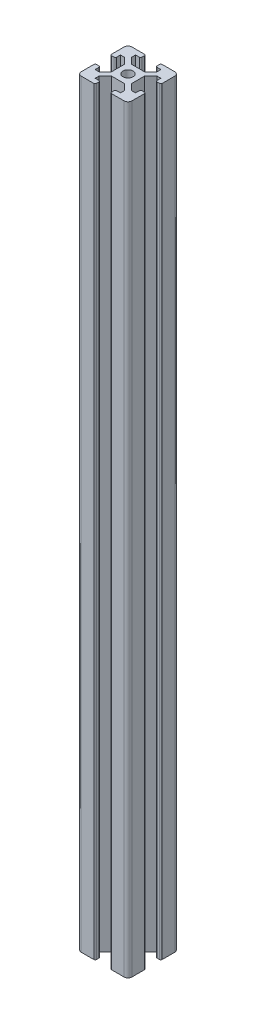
SolidWorks part; units mm, degrees
ref_plane "Alzado" through (0, 0, 0) normal (0, 0, 1) x (1, 0, 0)
ref_plane "Planta" through (0, 0, 0) normal (0, 1, 0) x (1, 0, 0)
ref_plane "Vista lateral" through (0, 0, 0) normal (1, 0, 0) x (0, 0, -1)
sketch "Croquis1" plane through (0, 0, 0) normal (0, 1, 0) x (1, 0, 0)
  line L0 (-10, 10) -> (-3, 10)
  line L1 (-2.5858, -4) -> (2.5858, -4)
  line L2 (-4, -2.5858) -> (-4, 2.5858)
  line L3 (-2.5858, 4) -> (2.5858, 4)
  line L4 (4, -2.5858) -> (4, 2.5858)
  line L5 (-4, -4) -> (4, 4) construction
  line L6 (-1.4142, 1.4142) -> (4, -4) construction
  line L11 (-10, -10) -> (10, 10) construction
  line L12 (5, 8) -> (5, 6.4142)
  line L13 (-3, 10) -> (-3, 8)
  line L20 (-8, 5) -> (-6.4142, 5)
  line L21 (-5, 8) -> (-5, 6.4142)
  line L30 (-3, 8) -> (-5, 8)
  line L31 (-10, 3) -> (-8, 3)
  line L32 (-8, 3) -> (-8, 5)
  line L33 (0, 14.0655) -> (0, -11.7776) construction
  line L34 (-14.7196, 0) -> (20.6254, 0) construction
  line L35 (-2.5858, 4) -> (-5, 6.4142)
  line L36 (-4, 2.5858) -> (-6.4142, 5)
  line L37 (3, 8) -> (5, 8)
  line L38 (3, 10) -> (3, 8)
  line L39 (10, 3) -> (8, 3)
  line L40 (-1.4142, 1.4142) -> (10, -10) construction
  line L41 (8, 3) -> (8, 5)
  line L42 (8, 5) -> (6.4142, 5)
  line L43 (4, 2.5858) -> (6.4142, 5)
  line L44 (2.5858, 4) -> (5, 6.4142)
  line L45 (10, -3) -> (8, -3)
  line L46 (8, -3) -> (8, -5)
  line L47 (8, -5) -> (6.4142, -5)
  line L48 (4, -2.5858) -> (6.4142, -5)
  line L49 (5, -8) -> (5, -6.4142)
  line L50 (2.5858, -4) -> (5, -6.4142)
  line L51 (3, -8) -> (5, -8)
  line L52 (3, -10) -> (3, -8)
  line L53 (-3, -10) -> (-3, -8)
  line L54 (-3, -8) -> (-5, -8)
  line L55 (-10, -3) -> (-8, -3)
  line L56 (-8, -3) -> (-8, -5)
  line L57 (-8, -5) -> (-6.4142, -5)
  line L58 (-4, -2.5858) -> (-6.4142, -5)
  line L59 (-2.5858, -4) -> (-5, -6.4142)
  line L60 (-5, -8) -> (-5, -6.4142)
  line L63 (-10, -3) -> (-10, -10)
  line L66 (3, 10) -> (10, 10)
  line L67 (-10, 10) -> (-10, 3)
  line L68 (10, 10) -> (10, 3)
  line L69 (-10, -10) -> (-3, -10)
  line L70 (3, -10) -> (10, -10)
  line L71 (10, -10) -> (10, -3)
  circle A0 centre (0, 0) radius 2
  point P0 (0, 0)
  dimension "D3" = 4
  dimension "D2" = 8
  dimension "D4" = 20
  dimension "D5" = 20
  dimension "D14" = 2
  dimension "D16" = 2
extrude "Saliente-Extruir1" add sketch "Croquis1" along normal blind 300
fillet "Redondeo1" radius 1.5 4 edges at (10, 150, 10) (-10, 150, 10) (-10, 150, -10) (10, 150, -10)
fillet "Redondeo2" radius 0.5 16 edges at (3, 150, 10) (3, 150, 8) (-3, 150, 10) (-3, 150, 8) (-10, 150, 3) (-8, 150, 3) (10, 150, 3) (8, 150, 3) (-10, 150, -3) (-8, 150, -3) (-3, 150, -8) (3, 150, -8) (8, 150, -3) (10, 150, -3) (3, 150, -10) (-3, 150, -10)
